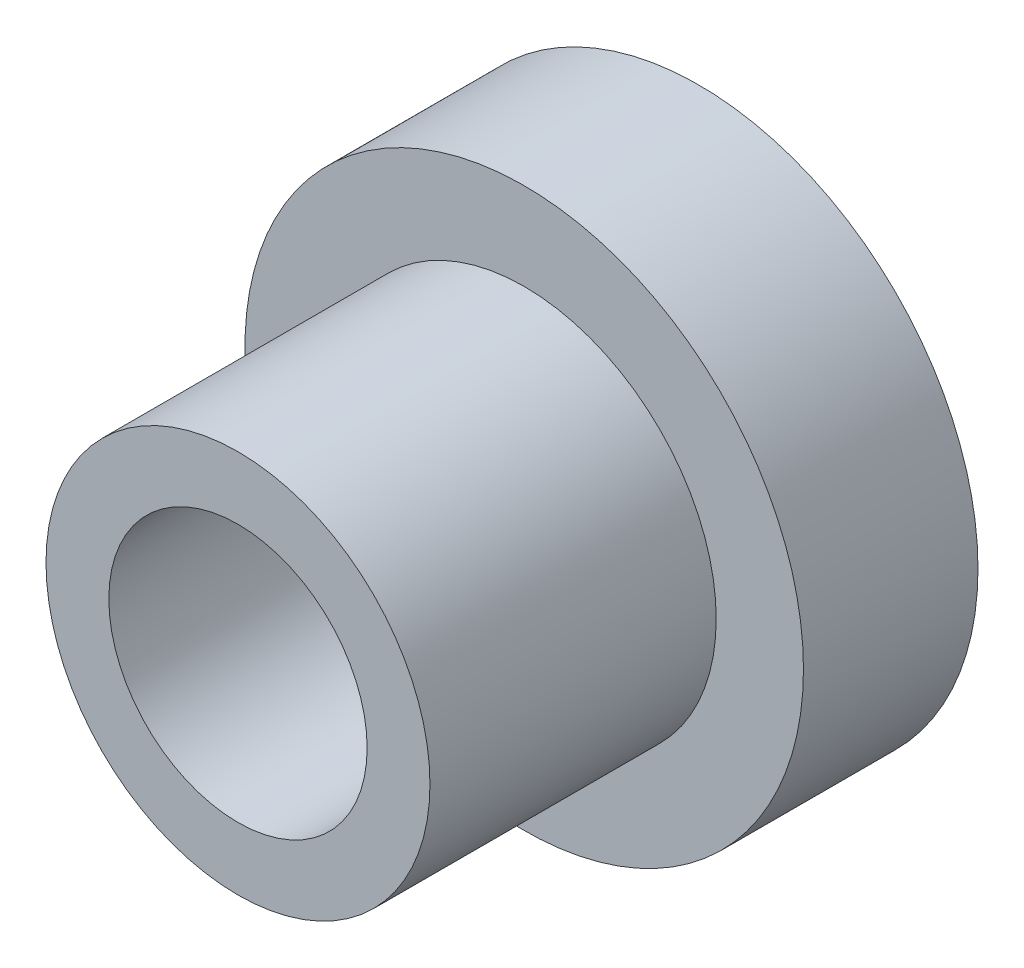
SolidWorks part; units mm, degrees
ref_plane "Front Plane" through (0, 0, 0) normal (0, 0, 1) x (1, 0, 0)
ref_plane "Top Plane" through (0, 0, 0) normal (0, 1, 0) x (1, 0, 0)
ref_plane "Right Plane" through (0, 0, 0) normal (1, 0, 0) x (0, 0, -1)
sketch "Sketch1" plane through (0, 0, 0) normal (0, 0, 1) x (1, 0, 0)
  circle A0 centre (0, 0) radius 10.16
  dimension "D1" = 20.32
extrude "Boss-Extrude1" add sketch "Sketch1" along normal blind 6.35
sketch "Sketch2" plane through (0, 0, 6.35) normal (0, 0, 1) x (1, 0, 0)
  circle A0 centre (0, 0) radius 6.985
  dimension "D1" = 13.97
extrude "Boss-Extrude2" add sketch "Sketch2" along normal blind 10.414
sketch "Sketch3" plane through (0, 0, 16.764) normal (0, 0, 1) x (1, 0, 0)
  circle A0 centre (0, 0) radius 4.699
  dimension "D1" = 9.398
extrude "Cut-Extrude1" cut sketch "Sketch3" against normal through all
